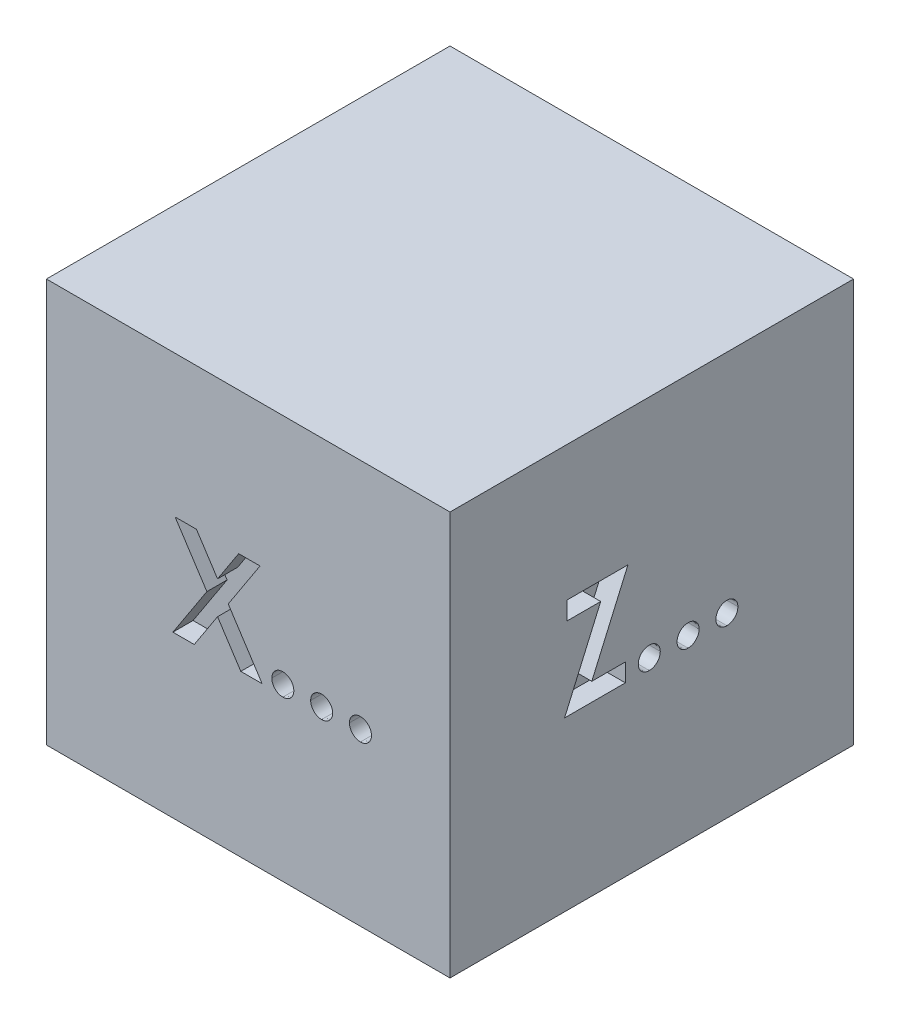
SolidWorks part; units mm, degrees
ref_plane "Front Plane" through (0, 0, 0) normal (0, 0, 1) x (1, 0, 0)
ref_plane "Top Plane" through (0, 0, 0) normal (0, 1, 0) x (1, 0, 0)
ref_plane "Right Plane" through (0, 0, 0) normal (1, 0, 0) x (0, 0, -1)
sketch "Sketch1" plane through (0, 0, 0) normal (0, 0, 1) x (1, 0, 0)
  line L1 (0, 0) -> (1, 0)
  line L2 (0, 0) -> (0, 1)
  line L3 (0, 1) -> (1, 1)
  line L4 (1, 0) -> (1, 1)
extrude "Boss-Extrude1" add sketch "Sketch1" along normal blind 1
sketch "Sketch2" plane through (1, 0, 0) normal (1, 0, 0) x (0, 0, -1)
  text T0 "Z..." font "Century Gothic" height 0.25
extrude "Cut-Extrude1" cut sketch "Sketch2" against normal blind 0.05
sketch "Sketch3" plane through (0, 0, 1) normal (0, 0, 1) x (1, 0, 0)
  text T0 "<b>X...</b>" font "Century Gothic" height 0.25
extrude "Cut-Extrude2" cut sketch "Sketch3" against normal blind 0.05
sketch "Sketch4" plane through (0, 0, 0) normal (-1, 0, 0) x (0, 0, 1)
  text T0 "<r90>Y" font "Century Gothic" height 0.25
extrude "Cut-Extrude3" cut sketch "Sketch4" against normal blind 0.05
sketch "Sketch5" plane through (0, 0, 0) normal (-1, 0, 0) x (0, 0, 1)
  text T0 "." font "Century Gothic" height 0.25
extrude "Cut-Extrude4" cut sketch "Sketch5" against normal blind 0.05
sketch "Sketch6" plane through (0, 0, 0) normal (-1, 0, 0) x (0, 0, 1)
  text T0 "." font "Century Gothic" height 0.25
extrude "Cut-Extrude5" cut sketch "Sketch6" against normal blind 0.05
sketch "Sketch7" plane through (0, 0, 0) normal (-1, 0, 0) x (0, 0, 1)
  text T0 "." font "Century Gothic" height 0.25
extrude "Cut-Extrude6" cut sketch "Sketch7" against normal blind 0.05
sketch "Sketch9" plane through (0, 0, 0) normal (0, 0, -1) x (-1, 0, 0)
  line L1 (-0.173, 0.8367) -> (-0.8278, 0.8367)
  line L2 (-0.173, 0.8367) -> (-0.173, 0.1722)
  line L3 (-0.173, 0.1722) -> (-0.8278, 0.1722)
  line L4 (-0.8278, 0.8367) -> (-0.8278, 0.1722)
extrude "Cut-Extrude8" cut sketch "Sketch9" against normal blind 0.8
